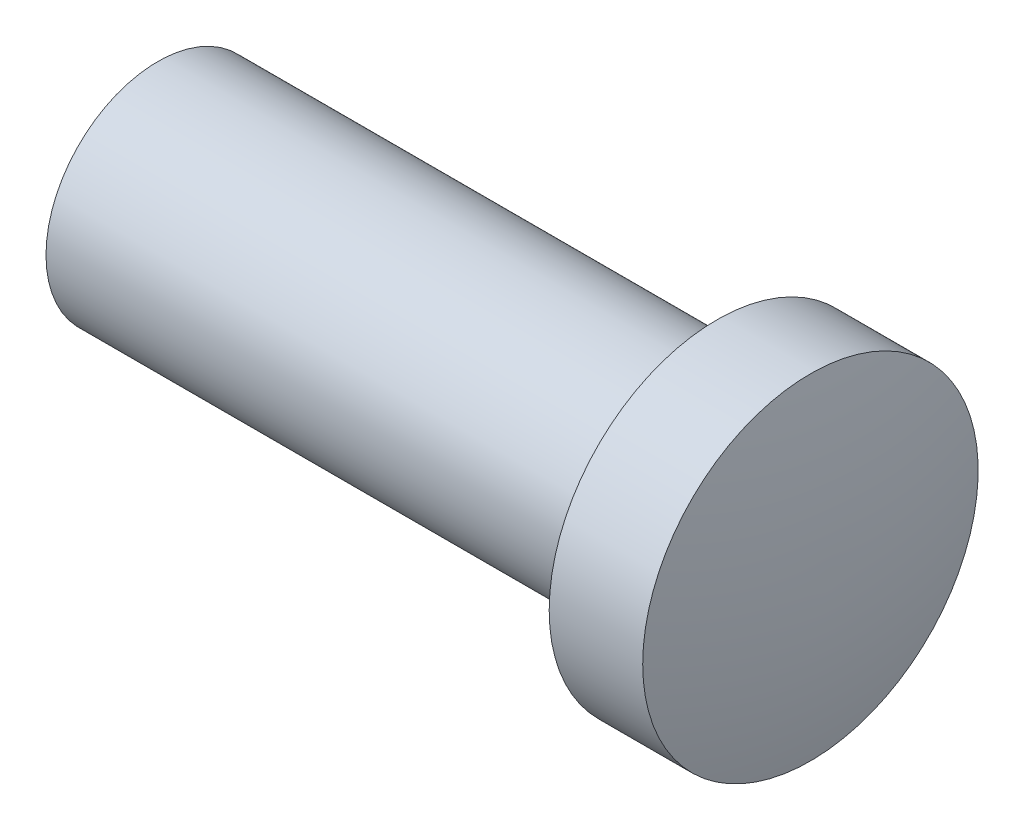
SolidWorks part; units mm, degrees
ref_plane "Plan1" through (0, 0, 0) normal (0, 0, 1) x (1, 0, 0)
ref_plane "Plan2" through (0, 0, 0) normal (0, 1, 0) x (1, 0, 0)
ref_plane "Plan3" through (0, 0, 0) normal (1, 0, 0) x (0, 0, -1)
sketch "Esquisse1" plane through (0, 0, 0) normal (0, 0, 1) x (1, 0, 0)
  line L0 (-100, 151.8047) -> (-44.3717, 151.8047) construction
  line L177 (-68.6446, 151.8047) -> (-62.6446, 151.8047)
  line L182 (-68.6446, 151.8047) -> (-68.6446, 152.8047)
  line L184 (-68.6446, 152.8047) -> (-63.6446, 152.8047)
  line L186 (-63.6446, 152.8047) -> (-63.6446, 153.3047)
  line L188 (-63.6446, 153.3047) -> (-62.8083, 153.3047)
  arc A50 (-62.8083, 153.3047) -> (-62.6446, 151.8047) centre (-69.1493, 151.8538) cw
  dimension "D1" = 1
  dimension "D2" = 5
  dimension "D3" = 1.5
  dimension "D4" = 6
revolve "Base-Révolution" add sketch "Esquisse1" angle 360 about L0
sketch "Esquisse2" plane through (-68.6446, 0, 0) normal (-1, 0, 0) x (0, 0, 1)
  circle A0 centre (0, 151.8047) radius 0.75
  dimension "D1" = 1.5
extrude "Enlèv. mat.-Extru.1" cut sketch "Esquisse2" against normal blind 5
